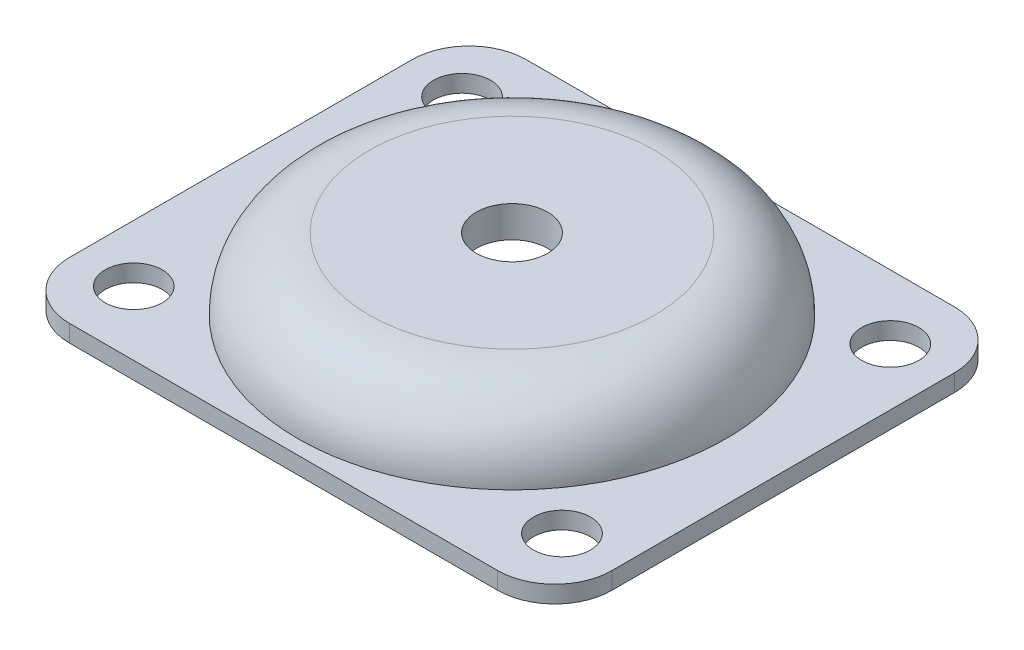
SolidWorks part; units mm, degrees
ref_plane "Ebene vorne" through (0, 0, 0) normal (0, 0, 1) x (1, 0, 0)
ref_plane "Ebene oben" through (0, 0, 0) normal (0, 1, 0) x (1, 0, 0)
ref_plane "Ebene rechts" through (0, 0, 0) normal (1, 0, 0) x (0, 0, -1)
sketch "Skizze1" plane through (0, 0, 0) normal (0, 1, 0) x (1, 0, 0)
  line L1 (-19, 16) -> (19, 16)
  line L2 (-19, 16) -> (-19, -16)
  line L3 (-19, -16) -> (19, -16)
  line L4 (19, 16) -> (19, -16)
  line L5 (-19, 16) -> (19, -16) construction
  line L6 (-19, -16) -> (19, 16) construction
  point P0 (0, 0)
  dimension "D1" = 38
  dimension "D2" = 32
extrude "Aufsatz-Linear austragen1" add sketch "Skizze1" along normal blind 1.2
sketch "Skizze2" plane through (0, 1.2, 0) normal (0, 1, 0) x (1, 0, 0)
  circle A0 centre (0, 0) radius 15
  dimension "D1" = 30
extrude "Aufsatz-Linear austragen2" add sketch "Skizze2" along normal blind 5
fillet "Verrundung1" radius 5 1 edges at (0, 6.2, 15)
sketch "Skizze3" plane through (0, 1.2, 0) normal (0, 1, 0) x (1, 0, 0)
  line L0 (-15.9477, 0) -> (17.1976, 0) construction
  line L5 (0, 8.9165) -> (0, -7.0585) construction
  circle A0 centre (-15, 11.5) radius 2
  circle A1 centre (15, 11.5) radius 2
  circle A2 centre (15, -11.5) radius 2
  circle A3 centre (-15, -11.5) radius 2
  point P0 (0, 0)
  dimension "D3" = 4
  dimension "D4" = 18.9011
  dimension "D1" = 23
extrude "Schnitt-Linear austragen1" cut sketch "Skizze3" against normal up to next
sketch "Skizze4" plane through (0, 0, 0) normal (0, -1, 0) x (1, 0, 0)
  circle A0 centre (0, 0) radius 14
  dimension "D1" = 28
extrude "Schnitt-Linear austragen2" cut sketch "Skizze4" against normal blind 4
fillet "Verrundung2" radius 4 1 edges at (0, 4, -14)
sketch "Skizze5" plane through (0, 6.2, 0) normal (0, 1, 0) x (1, 0, 0)
  circle A0 centre (0, 0) radius 2.5
  dimension "D1" = 5
extrude "Schnitt-Linear austragen3" cut sketch "Skizze5" against normal through all
fillet "Verrundung3" radius 4 4 edges at (-19, 0.6, 16) (-19, 0.6, -16) (19, 0.6, -16) (19, 0.6, 16)
